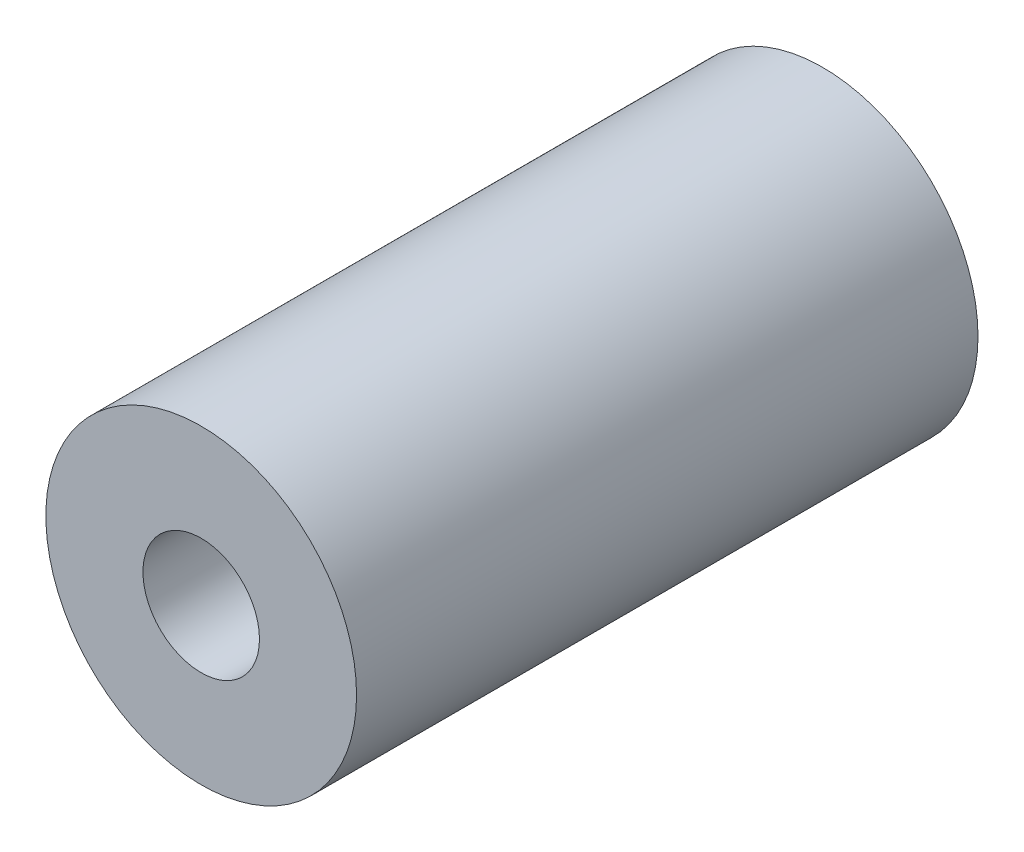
SolidWorks part; units mm, degrees
ref_plane "Front Plane" through (0, 0, 0) normal (0, 0, 1) x (1, 0, 0)
ref_plane "Top Plane" through (0, 0, 0) normal (0, 1, 0) x (1, 0, 0)
ref_plane "Right Plane" through (0, 0, 0) normal (1, 0, 0) x (0, 0, -1)
sketch "Sketch1" plane through (0, 0, 0) normal (0, 0, 1) x (1, 0, 0)
  circle A0 centre (0, 0) radius 4.7625
  circle A1 centre (0, 0) radius 12.7
  dimension "D1" = 9.525
  dimension "D2" = 25.4
extrude "Extrude1" add sketch "Sketch1" along normal blind 50.8
